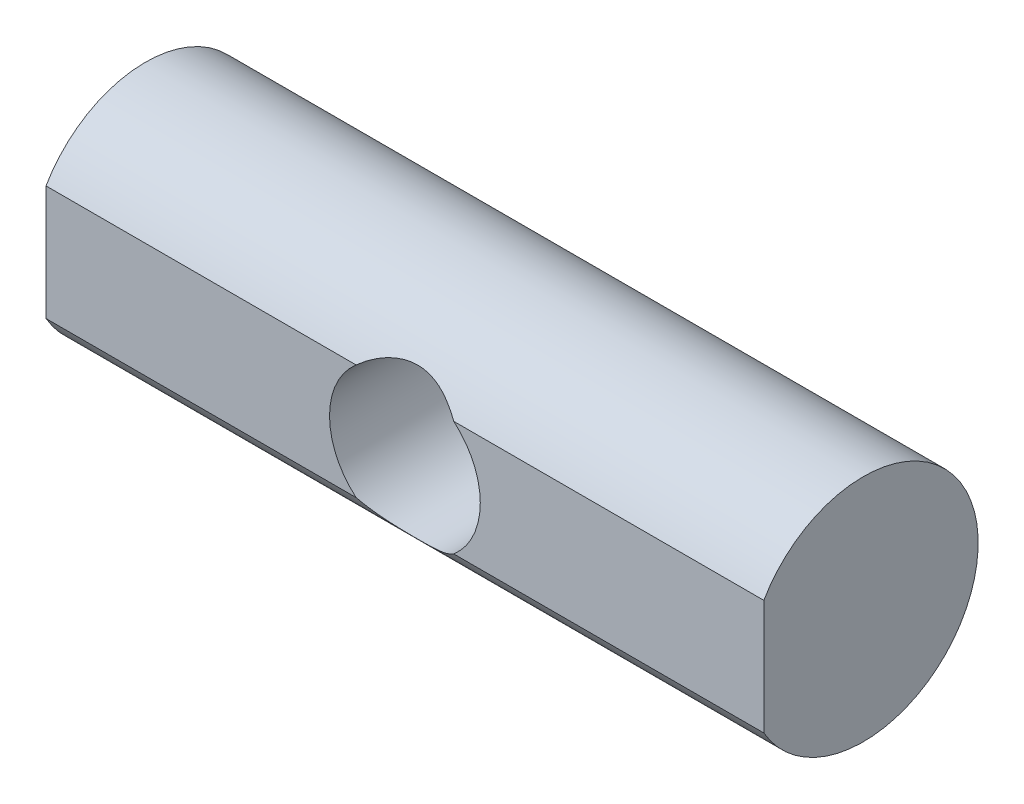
SolidWorks part; units mm, degrees
ref_plane "Front" through (0, 0, 0) normal (0, 0, 1) x (1, 0, 0)
ref_plane "Top" through (0, 0, 0) normal (0, 1, 0) x (1, 0, 0)
ref_plane "Right" through (0, 0, 0) normal (1, 0, 0) x (0, 0, -1)
sketch "Sketch1" plane through (0, 0, 0) normal (1, 0, 0) x (0, 0, -1)
  line L0 (-6.9282, 4) -> (-6.9282, -4)
  line L1 (0, 0) -> (8.7859, 0) construction
  circle A0 centre (0, 0) radius 8
  dimension "D1" = 16
  dimension "D2" = 8
extrude "Boss-Extrude1" add sketch "Sketch1" along normal mid plane 50
sketch "Sketch2" plane through (0, 0, 6.9282) normal (0, 0, 1) x (1, 0, 0)
  circle A0 centre (0, 0) radius 6
  dimension "D1" = 12
hole_wizard "M12x1.5 Tapped Hole1" positions "Sketch3" profile "Sketch4" tap size "M12x1.5" standard "ANSI Metric"
sketch "Sketch3" plane through (0, 0, 6.9282) normal (0, 0, 1) x (1, 0, 0)
  point P0 (0, 0)
sketch "Sketch4" plane through (0, 0, 6.9282) normal (1, 0, 0) x (0, -1, 0)
  line L0 (0, 0) -> (0, 14.9282)
  line L1 (0, 14.9282) -> (5.25, 14.9282)
  line L2 (5.25, 14.9282) -> (5.25, 0)
  line L5 (5.25, 0) -> (0, 0)
  line L11 (0, -6.35) -> (0, 107.95) construction
  dimension "Thru Tap Drill Dia." = 10.5
  dimension "Thru Tap Drill Depth" = 14.9282
